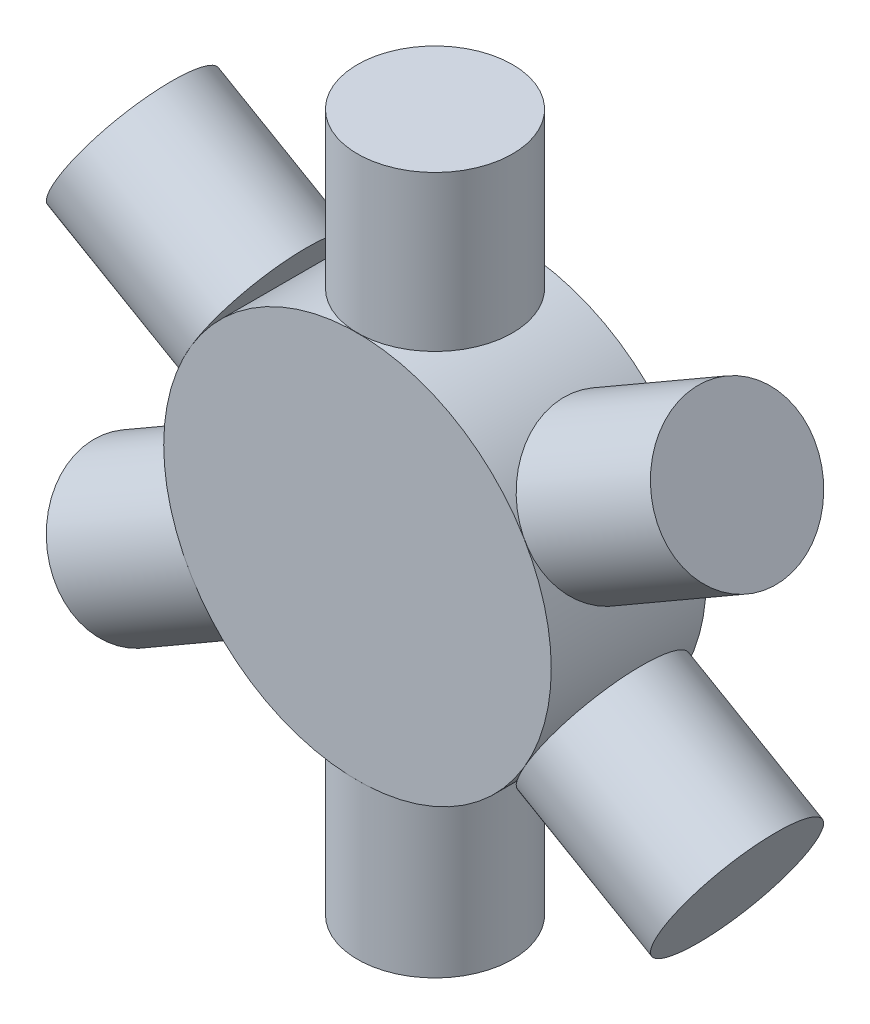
SolidWorks part; units mm, degrees
ref_plane "Front Plane" through (0, 0, 0) normal (0, 0, 1) x (1, 0, 0)
ref_plane "Top Plane" through (0, 0, 0) normal (0, 1, 0) x (1, 0, 0)
ref_plane "Right Plane" through (0, 0, 0) normal (1, 0, 0) x (0, 0, -1)
ref_plane "Front Plane-GloboidCam" through (0, 0, 0) normal (0, 0, 1) x (1, 0, 0)
ref_plane "Top Plane-GloboidCam" through (0, 0, 0) normal (0, 1, 0) x (1, 0, 0)
ref_plane "Right Plane-GloboidCam" through (0, 0, 0) normal (1, 0, 0) x (0, 0, -1)
sketch "MainGeometry-GloboidCam" plane through (0, 0, 0) normal (0, 0, 1) x (1, 0, 0)
  line L0 (-25.4251, 0) -> (32.6601, 0) construction
  line L1 (0, 0) -> (0, 80) construction
  line L2 (-15, 0) -> (15, 0)
  line L3 (-15, 0) -> (-15, 69)
  line L4 (-15, 69) -> (15, 69)
  line L5 (15, 0) -> (15, 69)
  line L6 (0, 80) -> (-20, 80) construction
  line L7 (-4, 70) -> (4, 70) construction
  line L8 (-4, 70) -> (-4, 62) construction
  line L9 (-4, 62) -> (4, 62) construction
  line L10 (4, 70) -> (4, 62) construction
  line L11 (50.3481, 57.4013) -> (56.3481, 57.4013) construction
  line L12 (49.5498, 46.5023) -> (73.5498, 46.5023) construction
  circle A0 centre (0, 80) radius 10 construction
  point P14 (0, 70)
  point P20 (56.3481, 57.4013)
  point P21 (53.5498, 46.5023)
sketch "CamTurnPerFollower180-GloboidCam" plane through (0, 0, 0) normal (1, 0, 0) x (0, 0, -1)
  line L0 (0, 80) -> (0, 0) construction
  line L2 (0, 0) -> (-56.5685, 56.5685) construction
  arc A0 (0, 80) -> (-56.5685, 56.5685) centre (0, 0) ccw
  dimension "D1" = 62.8319
  dimension "D2" = 80
  dimension "D3" = 45
sketch "Sketch3-GloboidCam" plane through (0, 0, 0) normal (0, 0, 1) x (1, 0, 0)
  line L1 (0, 80) -> (-20, 80)
inserted part "GloboidCam"
sketch "Sketch4" plane through (0, 0, 0) normal (0, 0, 1) x (1, 0, 0)
  circle A0 centre (0, 80) radius 10
  circle A1 centre (0, 80) radius 10 construction
extrude "Boss-Extrude1" add sketch "Sketch4" along normal mid plane 8
sketch "Sketch5" plane through (0, 0, 0) normal (0, 0, 1) x (1, 0, 0)
  line L0 (0, 0) -> (0, 80) construction
  line L1 (-4, 62) -> (0, 62)
  line L2 (-4, 62) -> (-4, 70)
  line L3 (-4, 70) -> (0, 70)
  line L4 (0, 62) -> (0, 70)
  line L5 (-4, 70) -> (4, 70) construction
revolve "Revolve1" add sketch "Sketch5" angle 360 about L4
pattern_circular "CirPattern1" count 6 over 360 about axis through (0, 80, 0) along (0, 0, 1)
equation "\"D1@CirPattern1\"= \"FollowerPins@MainGeometry-GloboidCam\" / 1"
